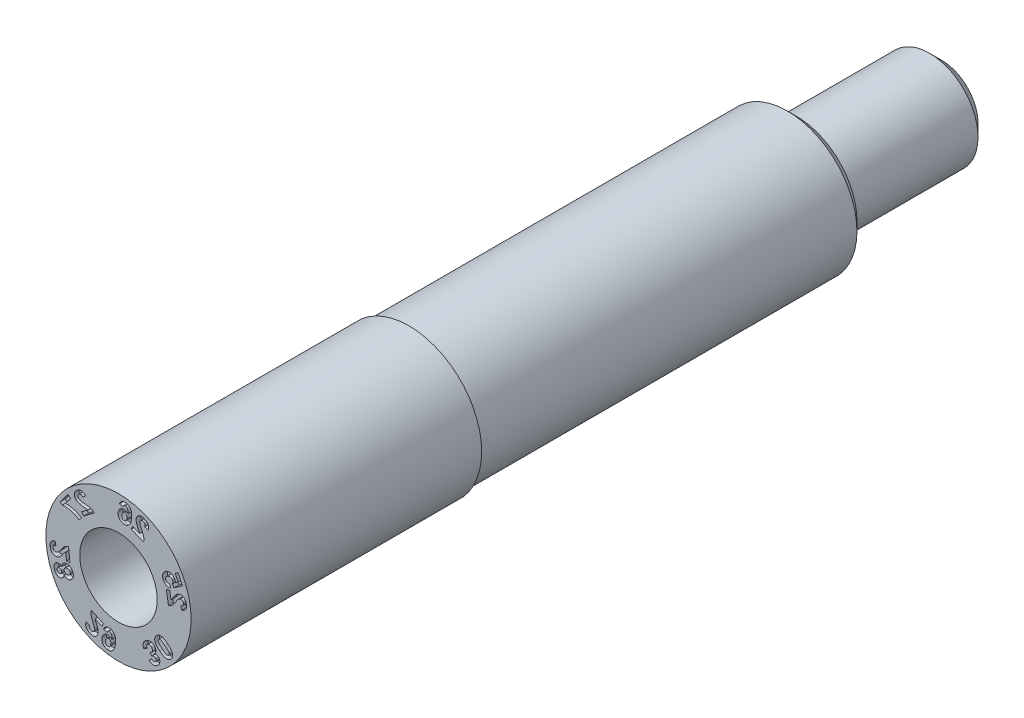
SolidWorks part; units mm, degrees
other "<M2 X .4 SHSS>-<Revolve1>"
ref_plane "Front Plane" through (0, 0, 0) normal (0, 0, 1) x (1, 0, 0)
ref_plane "Top Plane" through (0, 0, 0) normal (0, 1, 0) x (1, 0, 0)
ref_plane "Right Plane" through (0, 0, 0) normal (1, 0, 0) x (0, 0, -1)
sketch "Sketch1" plane through (0, 0, 0) normal (1, 0, 0) x (0, 0, -1)
  line L2 (0, 1.5) -> (0, 0.8)
  line L3 (13.75, 1.5) -> (0, 1.5)
  line L4 (-3.7979, 0) -> (49996.2021, 0) construction
  line L8 (11, 0.6) -> (2.2, 0.6)
  line L9 (2.2, 0.8) -> (2.2, 0.6)
  line L10 (2.2, 0.8) -> (0, 0.8)
  line L12 (14, 1) -> (14, 1.25)
  line L16 (14, 1.25) -> (13.75, 1.5)
  line L17 (14, 1) -> (11, 1)
  line L18 (11, 0.6) -> (11, 1)
  dimension "D1" = 14
  dimension "D2" = 45
  dimension "D3" = 0.25
  dimension "D4" = 3
  dimension "D5" = 1.6
  dimension "D6" = 2.2
  dimension "D7" = 1.2
  dimension "D8" = 2
  dimension "D9" = 3
revolve "Revolve1" add sketch "Sketch1" angle 360 about L4
sketch "Sketch5" plane through (0, 0, 0) normal (1, 0, 0) x (0, 0, -1)
  line L0 (0, 0) -> (50000, 0) construction
  line L1 (0, 1.5) -> (0, -1.5) construction
  line L2 (6, 1.435) -> (14, 1.435)
  line L3 (6, 1.435) -> (6, 2.435)
  line L4 (6, 2.435) -> (14, 2.435)
  line L5 (14, 1.435) -> (14, 2.435)
  line L6 (14, -1.25) -> (14, 1.25) construction
  line L7 (13.75, 1.5) -> (0, 1.5) construction
  dimension "D1" = 6
  dimension "D2" = 0.065
  dimension "D3" = 1
revolve "Cut-Revolve1" cut sketch "Sketch5" angle 360 about L0
sketch "Sketch2" plane through (0, 0, 0) normal (0, 0, 1) x (1, 0, 0)
  line L0 (0, 0) -> (0, 2.3112) construction
  line L1 (0, 0) -> (2.0015, 1.1556) construction
  line L2 (0, 0) -> (2.0015, -1.1556) construction
  line L3 (0, 0) -> (0, -2.3112) construction
  line L4 (0, 0) -> (-2.0015, -1.1556) construction
  line L5 (0, 0) -> (-2.0015, 1.1556) construction
  circle A0 centre (0, 0) radius 1.0342 construction
  text T0 "25    26    27    28    29    30" font "Arial" height 0.4
  point P10 (0, 0)
  point P746 (4, 0.001)
  point P747 (0.0034, 0.0034)
  point P748 (0.0034, 0)
  dimension "D1" = 6
extrude "Cut-Extrude1" cut sketch "Sketch2" against normal blind 0.1
sketch "Sketch3" plane through (0, 0, -2.2) normal (0, 0, 1) x (1, 0, 0)
  line L0 (0, 0) -> (0, 50000) construction
  line L1 (0.3464, 0.6) -> (-0.3464, 0.6)
  line L2 (-0.3464, 0.6) -> (-0.6928, 0)
  line L3 (-0.6928, 0) -> (-0.3464, -0.6)
  line L4 (-0.3464, -0.6) -> (0.3464, -0.6)
  line L5 (0.3464, -0.6) -> (0.6928, 0)
  line L6 (0.6928, 0) -> (0.3464, 0.6)
  line L7 (0, 0) -> (50000, 0) construction
  circle A0 centre (0, 0) radius 0.6 construction
  circle A1 centre (0, 0) radius 0.6 construction
extrude "Cut-Extrude2" cut sketch "Sketch3" against normal blind 1.4
inserted part "M2 X .4 SHSS"
move or copy body "Body-Move/Copy2" placed by mates yes
